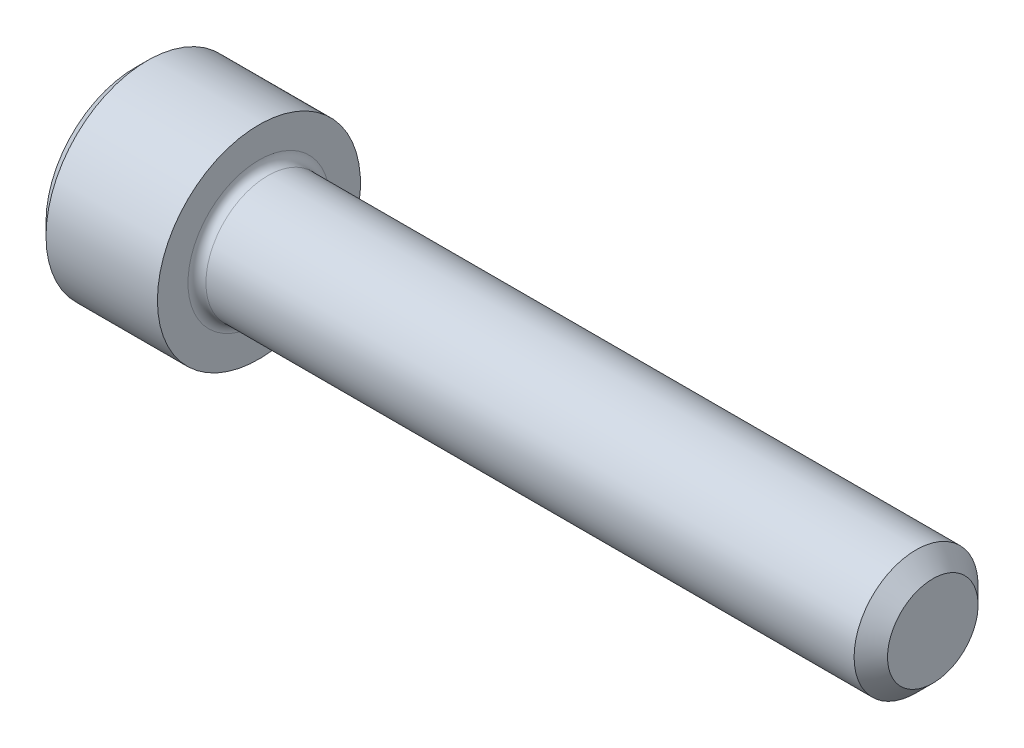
SolidWorks part; units mm, degrees
ref_plane "Plane1" through (0, 0, 0) normal (0, 0, 1) x (1, 0, 0)
ref_plane "Plane2" through (0, 0, 0) normal (0, 1, 0) x (1, 0, 0)
ref_plane "Plane3" through (0, 0, 0) normal (1, 0, 0) x (0, 0, -1)
revolve "Base-Revolve" add sketch "BodySke"
sketch "BodySke" plane through (0, 0, 0) normal (0, 0, 1) x (1, 0, 0)
  line L0 (0, 0) -> (0, 2.5146)
  line L1 (0.3556, 2.8702) -> (3.5052, 2.8702)
  line L2 (3.5052, 2.8702) -> (3.5052, 1.7526)
  line L3 (3.5052, 1.7526) -> (22.0828, 1.7526)
  line L4 (22.5552, 1.2802) -> (22.5552, 0)
  line L5 (22.5552, 0) -> (0, 0)
  line L6 (-31.75, 0) -> (127, 0) construction
  line L7 (0, 2.5146) -> (0.3556, 2.8702)
  line L8 (22.5552, 1.2802) -> (22.0828, 1.7526)
  line L9 (0, -2.5146) -> (0.3556, -2.8702) construction
  line L10 (22.5552, -1.2802) -> (22.0828, -1.7526) construction
  line L11 (4.2977, 9.525) -> (4.2977, 3.175) construction
  line L12 (3.5052, 9.525) -> (3.5052, 3.175) construction
  line L13 (-15.5448, 9.525) -> (-15.5448, 3.175) construction
  dimension "Diameter" = 3.5052
  dimension "Head_ht" = 3.5052
  dimension "Length" = 19.05
  dimension "Body_ch_ang" = 45
  dimension "Head_dia" = 5.7404
  dimension "Head_ch_ang" = 45
  dimension "Head_side_ht" = 3.1496
  dimension "Minor_dia" = 2.5603
  dimension "Advance" = 0.7925
  dimension "Thread_nom" = 19.05
  dimension "Thread_length" = 38.1
fillet "Fillet1" radius 0.254 1 edges at (3.5052, 0, 1.7526)
sketch "Sketch2" plane through (0, 0, 0) normal (0, 0, 1) x (1, 0, 0)
  line L0 (0, 1.3843) -> (1.6256, 1.3843)
  line L1 (1.6256, 1.3843) -> (2.4248, 0)
  line L2 (-31.75, 0) -> (127, 0) construction
  line L3 (2.4248, 0) -> (0, 0)
  line L4 (0, 0) -> (0, 1.3843)
  line L5 (0, 2.5146) -> (0, -2.5146) construction
  line L6 (0, 0) -> (47.625, 0) construction
  line L7 (3.5052, -2.8702) -> (3.5052, 2.8702) construction
  dimension "D1" = 1.3843
  dimension "D2" = 60
  dimension "Wall_thickness" = 1.8796
revolve "Hex-PreBroach" cut sketch "Sketch2" angle 360 about L6
sketch "Sketch3" plane through (0, 0, 0) normal (-1, 0, 0) x (0, 0.5, 0.866)
  line L0 (0.7992, 1.3843) -> (-0.7992, 1.3843)
  line L1 (-0.7992, 1.3843) -> (-1.5985, 0)
  line L2 (0.7992, 1.3843) -> (1.5985, 0)
  line L3 (0.7992, -1.3843) -> (1.5985, 0)
  line L4 (0.7992, -1.3843) -> (-0.7992, -1.3843)
  line L5 (-0.7992, -1.3843) -> (-1.5985, 0)
  dimension "D1" = 1.3843
  dimension "D2" = 1.3843
  dimension "Hex_size" = 2.7686
extrude "Hex" cut sketch "Sketch3" against normal blind 1.6256
sketch "Sketch4" plane through (0, 0, 0) normal (-1, 0, 0) x (0, 0, 1)
  line L0 (0, 0) -> (1.7399, 0)
  line L1 (0, 0) -> (6.1484, 3.5498) construction
  line L2 (0, 0) -> (0.8699, 1.5068)
  line L3 (1.4457, 0.3947) -> (1.6607, 0.5189)
  line L4 (1.0647, 1.0546) -> (1.2797, 1.1788)
  arc A0 (1.4457, 0.3947) -> (1.0647, 1.0546) centre (0, 0) ccw
  arc A1 (1.7399, 0) -> (1.6607, 0.5189) centre (0, 0) ccw
  arc A2 (0.8699, 1.5068) -> (1.2797, 1.1788) centre (0, 0) cw
  dimension "D1" = 30
  dimension "Spline_n_dim" = 2.9972
  dimension "Spline_m_dim" = 3.4798
  dimension "D2" = 60
  dimension "D3" = 0.381
  dimension "Spline_p_dim" = 0.762
extrude "Spline" cut sketch "Sketch4" against normal blind 1.6256
pattern_circular "CirPattern1" count 6 every 60
sketch "Sketch5" plane through (0, 0, 0) normal (0, 0, 1) x (1, 0, 0)
  line L0 (-31.75, 0) -> (127, 0) construction
  line L2 (0, 2.5146) -> (0, -2.5146) construction
  circle A0 centre (1.27, 0) radius 0.4445
  dimension "Drilled_hole_dia" = 0.889
  dimension "Drilled_hole_loc" = 1.27
extrude "Hole" cut sketch "Sketch5" against normal through all and the other way through all
pattern_circular "Drilled-4" count 2 every 60
pattern_circular "Drilled-6" count 3 every 60
sketch "ThdSchSke" plane through (0, 0, 0) normal (0, 0, 1) x (1, 0, 0)
  line L0 (4.2977, -1.2802) -> (3.9669, -1.7526)
  line L1 (4.2977, -1.2802) -> (4.6285, -1.7526)
  line L2 (4.6285, -1.7526) -> (4.6285, -2.1908)
  line L3 (-3.175, 0) -> (5.1513, 0) construction
  line L5 (4.6285, -2.1908) -> (3.9669, -2.1908)
  line L6 (3.9669, -2.1908) -> (3.9669, -1.7526)
  line L7 (0, 2.5146) -> (0, -2.5146) construction
  dimension "Thread_minor" = 2.5603
  dimension "Diameter" = 3.5052
  dimension "Start" = 4.2977
  dimension "SideAngle" = 55
  dimension "VeeAngle" = 70
  dimension "Overcut" = 4.3815
revolve "ThreadSchematic" cut sketch "ThdSchSke" angle 360 about L3
pattern_linear "ThdSchPat"
equation "\"D2@Sketch3\" = \"Hex_size@Sketch3\" / 2"
equation "\"D1@Sketch3\" = \"Hex_size@Sketch3\" / 2"
equation "\"D1@Sketch2\" = \"Hex_size@Sketch3\" / 2"
equation "\"D3@Sketch4\" = \"Spline_p_dim@Sketch4\" / 2"
equation "\"Thread_minor@ThreadCosmetic\"  =  \"Minor_dia@BodySke\""
equation "\"D2@CirPattern1\" = 360 / \"Num_teeth@CirPattern1\""
equation "\"Wall_thickness@Sketch2\" = \"Head_ht@BodySke\" - \"Key_eng@Hex\""
equation "\"Thread_length@ThreadCosmetic\" = ((sgn( (\"Length@BodySke\" - \"Advance@BodySke\" ) - \"Thread_nom@BodySke\" )-1)*( (\"Length@BodySke\" - \"Advance@BodySke\" ) - \"Thread_nom@BodySke\" ))/-2+ \"Thread_nom@BodySke\""
equation "\"Thread_minor@ThdSchSke\" = \"Minor_dia@BodySke\""
equation "\"Diameter@ThdSchSke\" = \"Diameter@BodySke\""
equation "\"Overcut@ThdSchSke\" = \"Diameter@BodySke\" * 1.25"
equation "\"Start@ThdSchSke\" = \"Head_ht@BodySke\" + \"Length@BodySke\" - \"Thread_length@ThreadCosmetic\"  '---Non-countersunk---"
equation "\"Num_threads@ThdSchPat\" = int( \"Thread_length@ThreadCosmetic\" / \"Advance@BodySke\" + 0.999 )  + 1"
equation "\"Advance@ThdSchPat\" = \"Thread_length@ThreadCosmetic\" /  (\"Num_threads@ThdSchPat\" - 1) 'relax it"
equation "\"Num_threads@ThdSchPat\" = \"Num_threads@ThdSchPat\" - sgn( \"Num_threads@ThdSchPat\" - 1) '---chamfered tips only---"
